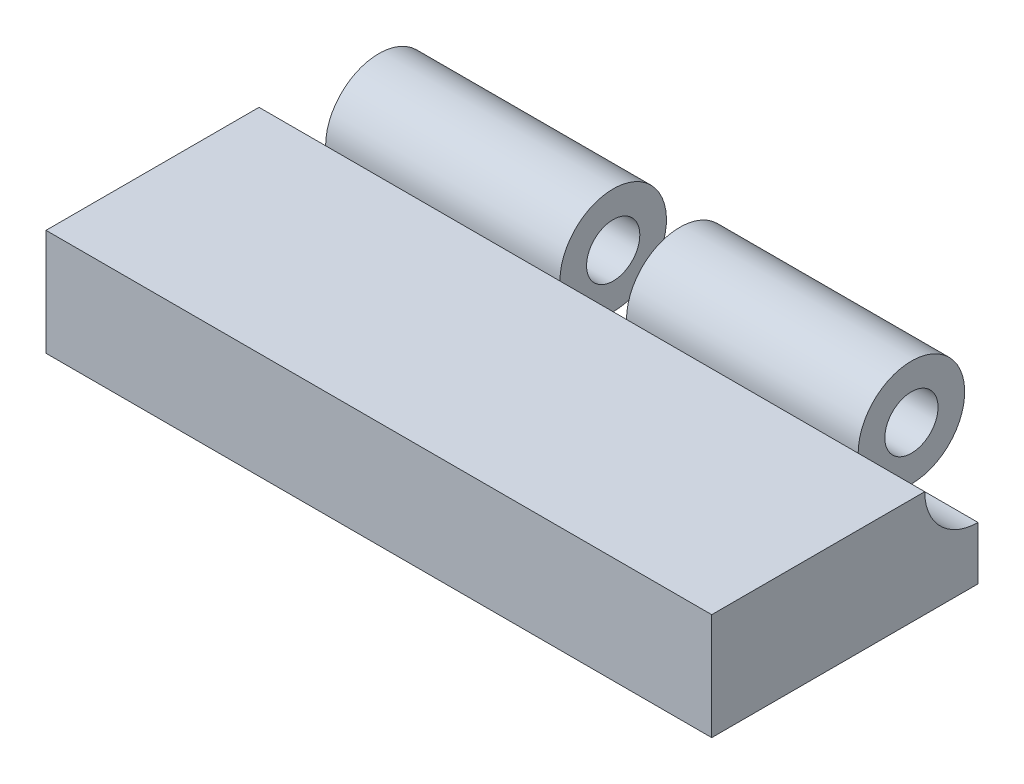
SolidWorks part; units mm, degrees
ref_plane "Front Plane" through (0, 0, 0) normal (0, 0, 1) x (1, 0, 0)
ref_plane "Top Plane" through (0, 0, 0) normal (0, 1, 0) x (1, 0, 0)
ref_plane "Right Plane" through (0, 0, 0) normal (1, 0, 0) x (0, 0, -1)
sketch "Sketch1" plane through (0, 0, 0) normal (0, 1, 0) x (1, 0, 0)
  line L1 (0, 0) -> (31.75, 0)
  line L2 (0, 0) -> (0, 12.7)
  line L3 (0, 12.7) -> (31.75, 12.7)
  line L4 (31.75, 0) -> (31.75, 12.7)
  dimension "D1" = 31.75
  dimension "D2" = 12.7
extrude "Boss-Extrude1" add sketch "Sketch1" along normal blind 5.08
ref_plane "Plane1" through (15.9385, 0, 0) normal (1, 0, 0) x (0, 0, -1)
sketch "Sketch2" plane through (15.9385, 0, 0) normal (1, 0, 0) x (0, 0, -1)
  circle A0 centre (12.7, 5.08) radius 2.54
  dimension "D1" = 5.08
extrude "Boss-Extrude2" add sketch "Sketch2" against normal offset from surface 3.175 and the other way offset from surface (12.6365 mm away) 3.175
sketch "Sketch3" plane through (0, 0, 0) normal (1, 0, 0) x (0, 0, -1)
  circle A0 centre (12.7, 5.08) radius 1.27
  dimension "D1" = 2.54
extrude "Cut-Extrude2" cut sketch "Sketch3" along normal through all
sketch "Sketch4" plane through (31.75, 0, 0) normal (1, 0, 0) x (0, 0, -1)
  circle A0 centre (12.7, 5.08) radius 2.54
  dimension "D1" = 5.08
extrude "Cut-Extrude3" cut sketch "Sketch4" against normal up to surface (3.175 mm away)
sketch "Sketch5" plane through (0, 0, 0) normal (-1, 0, 0) x (0, 0, 1)
  circle A0 centre (-12.7, 5.08) radius 2.54
  dimension "D1" = 5.08
extrude "Cut-Extrude4" cut sketch "Sketch5" against normal up to surface (3.175 mm away)
sketch "Sketch6" plane through (15.9385, 0, 0) normal (1, 0, 0) x (0, 0, -1)
  circle A0 centre (12.7, 5.08) radius 2.54
  dimension "D1" = 5.08
extrude "Cut-Extrude5" cut sketch "Sketch6" against normal blind 1.5875 and the other way blind 1.5875
